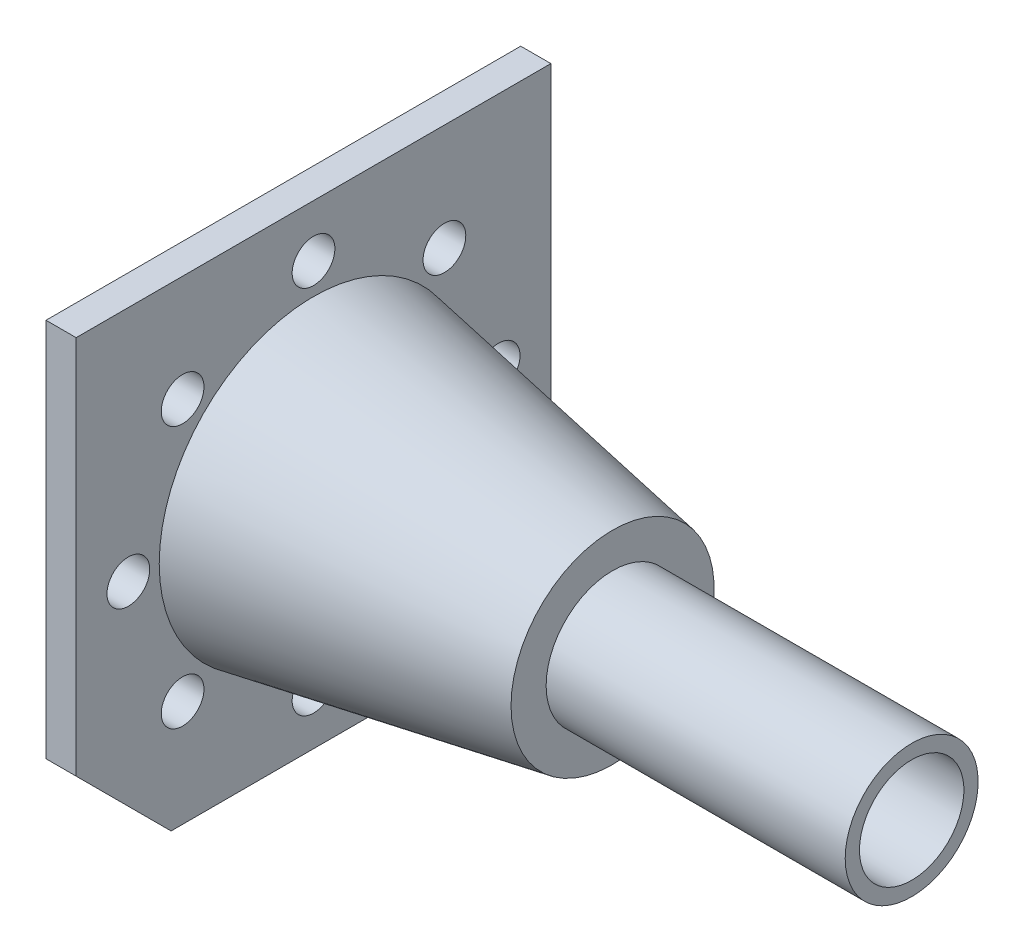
SolidWorks part; units mm, degrees
ref_plane "Front Plane" through (0, 0, 0) normal (0, 0, 1) x (1, 0, 0)
ref_plane "Top Plane" through (0, 0, 0) normal (0, 1, 0) x (1, 0, 0)
ref_plane "Right Plane" through (0, 0, 0) normal (1, 0, 0) x (0, 0, -1)
sketch "Sketch1" plane through (0, 0, 0) normal (1, 0, 0) x (0, -1, 0)
  line L1 (-50, -50) -> (50, -50)
  line L2 (-50, -50) -> (-50, 50)
  line L3 (-50, 50) -> (50, 50)
  line L4 (50, -50) -> (50, 50)
  line L5 (-50, -50) -> (50, 50) construction
  line L6 (-50, 50) -> (50, -50) construction
  dimension "D1" = 100
extrude "Boss-Extrude1" add sketch "Sketch1" along normal blind 6.35
sketch "Sketch5" plane through (0, 0, 0) normal (0, 0, 1) x (1, 0, 0)
  line L0 (6.35, 0) -> (69.35, 0)
  line L1 (6.35, 50) -> (6.35, -50) construction
  line L4 (69.35, 0) -> (69.35, -21.3914)
  line L5 (69.35, -21.3914) -> (6.35, -32.5)
  line L6 (6.35, -32.5) -> (6.35, 0)
  line L8 (6.35, 0) -> (99.4306, 0) construction
  dimension "D1" = 80
  dimension "D2" = 65
  dimension "D3" = 63
revolve "Revolve1" add sketch "Sketch5" angle 360 about L0
sketch "Sketch2" plane through (6.35, 0, 0) normal (1, 0, 0) x (0, -1, 0)
  line L0 (-39, 0) -> (0, 0) construction
  circle A1 centre (-39, 0) radius 4.5
  dimension "D1" = 39
  dimension "D2" = 9
extrude "Cut-Extrude1" cut sketch "Sketch2" against normal through all
sketch "Sketch6" plane through (69.35, 0, 0) normal (-1, 0, 0) x (0, 1, 0)
  circle A0 centre (0, 0) radius 14
  circle A1 centre (0, 0) radius 11
  circle A2 centre (0, 0) radius 21.3914 construction
  dimension "D1" = 22
  dimension "D2" = 28
pattern_circular "CirPattern1" count 8 over 360 about axis through (0, 0, 0) along (1, 0, 0) of "Cut-Extrude1"
extrude "Boss-Extrude2" add sketch "Sketch6" against normal blind 63
chamfer "Chamfer1" distance 20 angle 45 1 edges at (3.175, -50, 50)
